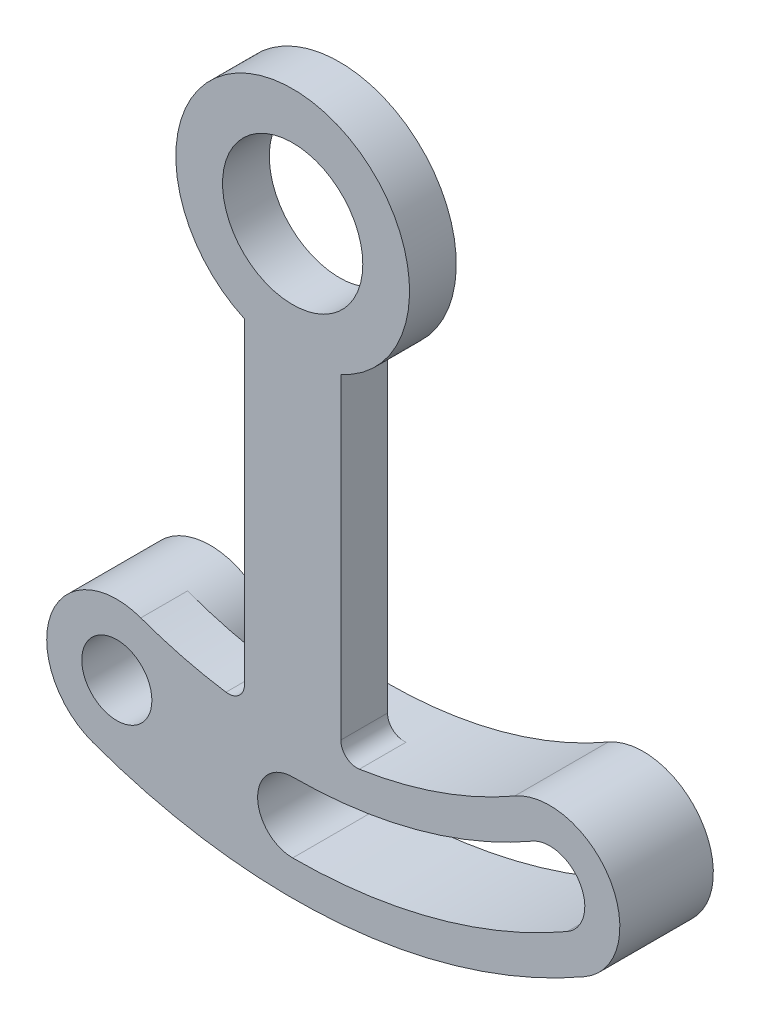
SolidWorks part; units mm, degrees
ref_plane "前视基准面" through (0, 0, 0) normal (0, 0, 1) x (1, 0, 0)
ref_plane "上视基准面" through (0, 0, 0) normal (0, 1, 0) x (1, 0, 0)
ref_plane "右视基准面" through (0, 0, 0) normal (1, 0, 0) x (0, 0, -1)
sketch "草图1" plane through (0, 0, 0) normal (0, 0, 1) x (1, 0, 0)
  line L0 (0, 0) -> (19.3366, -33.4919) construction
  line L1 (0, 0) -> (0, -42.2149) construction
  line L2 (0, 0) -> (-15.5446, -42.7084) construction
  line L3 (-2.059, -4.5564) -> (-2.059, -18.1019)
  line L5 (2.059, -4.5564) -> (2.059, -18.1019)
  arc A0 (2.059, -4.5564) -> (-2.059, -4.5564) centre (0, 0) ccw
  circle A1 centre (0, 0) radius 3
  arc A2 (-8.5505, -23.4923) -> (12.5, -21.6506) centre (0, 0) ccw
  arc A3 (-6.4984, -17.8542) -> (-8.5505, -23.4923) centre (-7.5244, -20.6732) ccw
  arc A4 (12.5, -21.6506) -> (9.5, -16.4545) centre (11, -19.0526) ccw
  arc A5 (-6.4984, -17.8542) -> (-2.8531, -18.7846) centre (0, 0) ccw
  arc A6 (2.059, -18.1019) -> (2.8531, -18.7846) centre (2.7494, -18.1019) ccw
  arc A7 (-2.059, -18.1019) -> (-2.8531, -18.7846) centre (-2.7494, -18.1019) cw
  arc A8 (2.8531, -18.7846) -> (9.5, -16.4545) centre (0, 0) ccw
  arc A9 (11.75, -20.3516) -> (10.25, -17.7535) centre (11, -19.0526) ccw
  arc A11 (0, -20.5) -> (0, -23.5) centre (0, -22) ccw
  arc A12 (0, -20.5) -> (10.25, -17.7535) centre (0, 0) ccw
  arc A13 (0, -23.5) -> (11.75, -20.3516) centre (0, 0) ccw
  circle A14 centre (-7.5244, -20.6732) radius 1.5
  dimension "D1" = 30
  dimension "D3" = 10
  dimension "D4" = 22
  dimension "D5" = 6
  dimension "D2" = 20
extrude "拉伸1" add sketch "草图1" along normal blind 2
sketch "草图2" plane through (0, 0, 0) normal (0, 0, -1) x (-1, 0, 0)
  circle A0 centre (7.5244, -20.6732) radius 1.5
  circle A1 centre (7.5244, -20.6732) radius 3
  arc A2 (-10.25, -17.7535) -> (-11.75, -20.3516) centre (-11, -19.0526) ccw
  arc A3 (0, -23.5) -> (0, -20.5) centre (0, -22) ccw
  arc A4 (-9.5, -16.4545) -> (-12.5, -21.6506) centre (-11, -19.0526) ccw
  arc A5 (0, -25) -> (0, -19) centre (0, -22) ccw
  arc A6 (-9.5, -16.4545) -> (0, -19) centre (0, 0) ccw
  arc A7 (-12.5, -21.6506) -> (0, -25) centre (0, 0) ccw
  arc A8 (-10.25, -17.7535) -> (0, -20.5) centre (0, 0) ccw
  arc A9 (-11.75, -20.3516) -> (0, -23.5) centre (0, 0) ccw
extrude "拉伸2" add sketch "草图2" along normal blind 2
